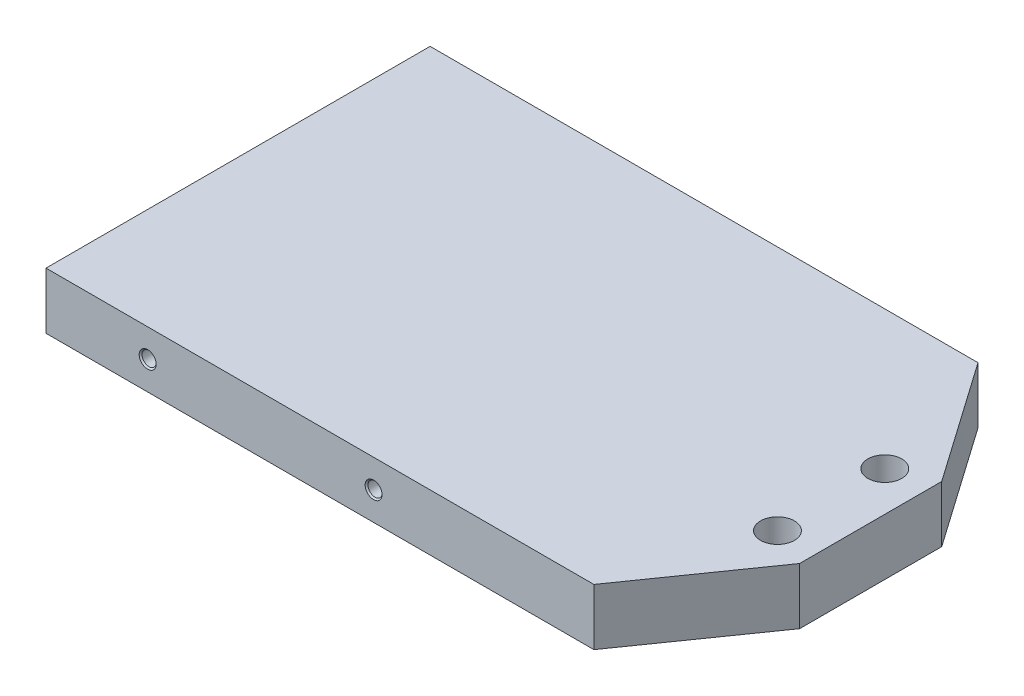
SolidWorks part; units mm, degrees
ref_plane "Face" through (0, 0, 0) normal (0, 0, 1) x (1, 0, 0)
ref_plane "Dessus" through (0, 0, 0) normal (0, 1, 0) x (1, 0, 0)
ref_plane "Profil" through (0, 0, 0) normal (1, 0, 0) x (0, 0, -1)
sketch "Esquisse1" plane through (0, 0, 0) normal (0, 0, 1) x (1, 0, 0)
  line L1 (0, -5) -> (112, -5)
  line L2 (0, -5) -> (0, 5)
  line L3 (0, 5) -> (112, 5)
  line L4 (112, -5) -> (112, 5)
  point P4 (0, 0)
  dimension "D1" = 112
  dimension "D2" = 10
extrude "Extrusion1" add sketch "Esquisse1" along normal mid plane 68
hole_wizard "Trou taraudé M5x0.81" positions "Esquisse3" profile "Esquisse2" tap size "M5x0.8" standard "ISO"
sketch "Esquisse3" plane through (0, 0, 0) normal (-1, 0, 0) x (0, 0, 1)
  line L0 (50, 0) -> (-50, 0) construction
  point P0 (-29, 0)
  dimension "D1" = 29
sketch "Esquisse2" plane through (0, 0, -29) normal (0, 1, 0) x (0, 0, 1)
  line L0 (0, 0) -> (0, 16.2618)
  line L1 (0, 16.2618) -> (2.1, 15)
  line L2 (2.1, 15) -> (2.1, 0.4)
  line L3 (2.1, 0.4) -> (2.5, 0)
  line L5 (2.5, 0) -> (0, 0)
  line L6 (-2.1, 0.4) -> (-2.5, 0) construction
  line L10 (0, 16.2618) -> (-2.1, 15) construction
  line L11 (0, -6.35) -> (0, 107.95) construction
  dimension "Diamètre du trou pour taraudage" = 4.2
  dimension "Profondeur du trou pour taraudage" = 15
  dimension "Diamètre du fraisage entrant" = 5
  dimension "Angle du fraisage entrant" = 90
  dimension "Angle de pointe" = 118
pattern_linear "Répétition linéaire1" count 2 spacing 58 along (0, 0, 1) of "Trou taraudé M5x0.81"
hole_wizard "Diamètre du perçage M5.0 (5.000000)1" positions "Esquisse5" profile "Esquisse6" hole size "M5.0" standard "ISO"
sketch "Esquisse5" plane through (0, 0, 0) normal (-1, 0, 0) x (0, 0, 1)
  line L0 (50, 0) -> (-50, 0) construction
  point P0 (-22.5, 0)
  dimension "D1" = 22.5
sketch "Esquisse6" plane through (0, 0, -22.5) normal (0, 1, 0) x (0, 0, 1)
  line L0 (0, 0) -> (0, 13.5022)
  line L1 (0, 13.5022) -> (2.5, 12)
  line L2 (2.5, 12) -> (2.5, 0.5)
  line L3 (2.5, 0.5) -> (3, 0)
  line L5 (3, 0) -> (0, 0)
  line L6 (-2.5, 0.5) -> (-3, 0) construction
  line L10 (0, 13.5022) -> (-2.5, 12) construction
  line L11 (0, -6.35) -> (0, 107.95) construction
  dimension "Diamètre du perçage" = 5
  dimension "Profondeur du perçage" = 12
  dimension "Diamètre du fraisage entrant" = 6
  dimension "Angle du fraisage entrant" = 90
  dimension "Angle de pointe" = 118
pattern_linear "Répétition linéaire2" count 2 spacing 45 along (0, 0, 1) of "Diamètre du perçage M5.0 (5.000000)1"
hole_wizard "Chambrage pour vis à tête hexagonale M61" positions "Esquisse3D1" profile "Esquisse7" counterbore size "M6" standard "ISO"
sketch3d "Esquisse3D1"
  point P0 (105, -5, -9.5)
  dimension "D1" = 9.5
  dimension "D2" = 105
sketch "Esquisse7" plane through (105, -5, -9.5) normal (1, 0, 0) x (0, 0, -1)
  line L0 (0, 0) -> (0, 10)
  line L1 (0, 10) -> (3, 10)
  line L3 (3, 10) -> (3, 5.2)
  line L4 (5.5, 5.2) -> (3, 5.2)
  line L5 (5.5, 5.2) -> (5.5, 0.5)
  line L6 (5.5, 0.5) -> (6, 0)
  line L7 (6, 0) -> (0, 0)
  line L8 (-5.5, 0.5) -> (-6, 0) construction
  line L11 (0, -6.35) -> (0, 107.95) construction
  dimension "Diamètre du perçage jusqu'au prochain" = 6
  dimension "Profondeur du perçage jusqu'au prochain" = 10
  dimension "Diamètre du chambrage" = 11
  dimension "Profondeur du chambrage" = 5.2
  dimension "Diamètre du fraisage entrant" = 12
  dimension "Angle du fraisage entrant" = 90
pattern_linear "Répétition linéaire3" count 2 spacing 19 along (0, 0, 1) of "Chambrage pour vis à tête hexagonale M61"
sketch "Esquisse8" plane through (0, -5, 0) normal (0, -1, 0) x (1, 0, 0)
  line L0 (97, -34) -> (112, -12.5778)
  line L1 (0, -34) -> (112, -34) construction
  line L2 (112, 34) -> (112, -34) construction
  line L3 (50, 0) -> (-50, 0) construction
  dimension "D1" = 55
  dimension "D2" = 15
extrude "Enlèv. mat.-Extru.1" cut sketch "Esquisse8" against normal through all and the other way through all flip side to cut
mirror "Symétrie1" about plane through (0, 0, 0) normal (0, 0, 1) of "Enlèv. mat.-Extru.1"
hole_wizard "Trou taraudé M3x0.51" positions "Esquisse10" profile "Esquisse9" tap size "M3x0.5" standard "ISO"
sketch "Esquisse10" plane through (0, 0, 34) normal (0, 0, 1) x (1, 0, 0)
  line L0 (0, 5) -> (0, -5) construction
  line L1 (50, 0) -> (-50, 0) construction
  point P0 (18, 0)
  dimension "D1" = 18
sketch "Esquisse9" plane through (18, 0, 34) normal (1, 0, 0) x (0, -1, 0)
  line L0 (0, 0) -> (0, 10.7511)
  line L1 (0, 10.7511) -> (1.25, 10)
  line L2 (1.25, 10) -> (1.25, 0.25)
  line L3 (1.25, 0.25) -> (1.5, 0)
  line L5 (1.5, 0) -> (0, 0)
  line L6 (-1.25, 0.25) -> (-1.5, 0) construction
  line L10 (0, 10.7511) -> (-1.25, 10) construction
  line L11 (0, -6.35) -> (0, 107.95) construction
  dimension "Diamètre du trou pour taraudage" = 2.5
  dimension "Profondeur du trou pour taraudage" = 10
  dimension "Diamètre du fraisage entrant" = 3
  dimension "Angle du fraisage entrant" = 90
  dimension "Angle de pointe" = 118
pattern_linear "Répétition linéaire4" count 2 spacing 40 along (1, 0, 0) of "Trou taraudé M3x0.51"
hole_wizard "Trou taraudé M3x0.52" positions "Esquisse13" profile "Esquisse12" tap size "M3x0.5" standard "ISO"
sketch "Esquisse13" plane through (0, 0, -34) normal (0, 0, -1) x (-1, 0, 0)
  line L0 (0, 5) -> (0, -5) construction
  line L1 (50, 0) -> (-50, 0) construction
  point P0 (-18, 0)
  dimension "D1" = 18
sketch "Esquisse12" plane through (18, 0, -34) normal (1, 0, 0) x (0, 1, 0)
  line L0 (0, 0) -> (0, 10.7511)
  line L1 (0, 10.7511) -> (1.25, 10)
  line L2 (1.25, 10) -> (1.25, 0.25)
  line L3 (1.25, 0.25) -> (1.5, 0)
  line L5 (1.5, 0) -> (0, 0)
  line L6 (-1.25, 0.25) -> (-1.5, 0) construction
  line L10 (0, 10.7511) -> (-1.25, 10) construction
  line L11 (0, -6.35) -> (0, 107.95) construction
  dimension "Diamètre du trou pour taraudage" = 2.5
  dimension "Profondeur du trou pour taraudage" = 10
  dimension "Diamètre du fraisage entrant" = 3
  dimension "Angle du fraisage entrant" = 90
  dimension "Angle de pointe" = 118
pattern_linear "Répétition linéaire5" count 2 spacing 40 along (1, 0, 0) of "Trou taraudé M3x0.52"
